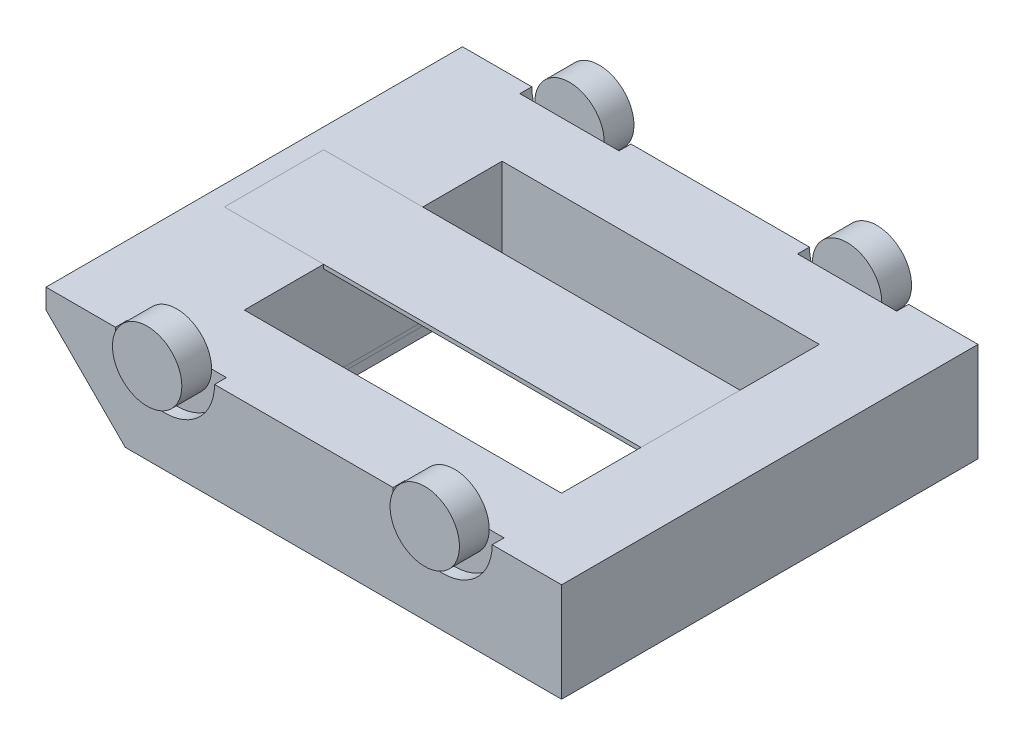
SolidWorks part; units mm, degrees
ref_plane "前视基准面" through (0, 0, 0) normal (0, 0, 1) x (1, 0, 0)
ref_plane "上视基准面" through (0, 0, 0) normal (0, 1, 0) x (1, 0, 0)
ref_plane "右视基准面" through (0, 0, 0) normal (1, 0, 0) x (0, 0, -1)
sketch "草图1" plane through (0, 0, 0) normal (0, 1, 0) x (1, 0, 0)
  line L0 (-400, 650) -> (-400, -650)
  line L1 (-800, -650) -> (800, -650)
  line L2 (-800, -650) -> (-800, 650)
  line L3 (-800, 650) -> (800, 650)
  line L4 (800, -650) -> (800, 650)
  line L5 (-800, -650) -> (800, 650) construction
  line L6 (-800, 650) -> (800, -650) construction
  line L7 (300, 650) -> (300, -650)
  line L8 (0, 0) -> (0, 815.0101) construction
  point P0 (0, 0)
  dimension "D1" = 1600
  dimension "D2" = 1300
  dimension "D3" = 400
other "槽钢 10(1)"
ref_plane "基准面1" through (-800, 0, 650) normal (0, 0, -1) x (0, 1, 0)
sketch "Sketch11" plane through (-800, 0, 650) normal (0, 0, -1) x (0, 1, 0)
  line L0 (0, 0) -> (0, -100)
  line L1 (0, -100) -> (-48, -100)
  line L2 (0, -50) -> (-5.3, -50) construction
  line L3 (-5.3, -82.1991) -> (-5.3, -17.8009)
  line L4 (-13.1549, -90.6746) -> (-44.0725, -93.0278)
  line L5 (-48, -97.2655) -> (-48, -100)
  line L6 (-5.3, -90.0767) -> (-5.3, -93.3267) construction
  line L7 (-5.3, -93.3267) -> (-48, -93.3267) construction
  line L8 (-24, -100) -> (-24, -91.5) construction
  line L9 (-48, -2.7345) -> (-48, 0)
  line L10 (0, 0) -> (-48, 0)
  line L11 (-13.1549, -9.3254) -> (-44.0725, -6.9722)
  arc A0 (-5.3, -82.1991) -> (-13.1549, -90.6746) centre (-13.8, -82.1991) cw
  arc A1 (-13.1549, -9.3254) -> (-5.3, -17.8009) centre (-13.8, -17.8009) cw
  arc A2 (-44.0725, -93.0278) -> (-48, -97.2655) centre (-43.75, -97.2655) ccw
  arc A3 (-48, -2.7345) -> (-44.0725, -6.9722) centre (-43.75, -2.7345) ccw
  point P2 (-24, 0)
  point P17 (0, 0)
  point P20 (-5.3, -9.9233)
  point P26 (-48, -6.6733)
  point P27 (0, 0)
  dimension "r" = 8.5
  dimension "r1" = 4.25
  dimension "h" = 100
  dimension "b" = 48
  dimension "d" = 5.3
  dimension "t" = 8.5
  dimension "D5" = 42.7
  dimension "D6" = 3.25
sketch "草图4" plane through (0, -5.3, 0) normal (0, -1, 0) x (1, 0, 0)
  line L0 (0, 0) -> (1143.0401, 0) construction
  line L1 (817.8009, 667.8009) -> (817.8009, -667.8009) construction
  line L2 (817.8009, -670) -> (882.1991, -670)
  line L3 (817.8009, -670) -> (817.8009, -690)
  line L4 (817.8009, -690) -> (882.1991, -690)
  line L5 (882.1991, -670) -> (882.1991, -690)
  line L6 (882.1991, 732.1991) -> (882.1991, -732.1991) construction
  line L7 (882.1991, 670) -> (882.1991, 690)
  line L8 (817.8009, 690) -> (882.1991, 690)
  line L9 (817.8009, 670) -> (817.8009, 690)
  line L10 (817.8009, 670) -> (882.1991, 670)
  line L12 (-882.1991, 440) -> (-817.8009, 440)
  line L13 (-882.1991, 440) -> (-882.1991, 420)
  line L14 (-882.1991, 420) -> (-817.8009, 420)
  line L15 (-817.8009, 440) -> (-817.8009, 420)
  line L17 (-817.8009, -440) -> (-817.8009, -420)
  line L18 (-882.1991, -420) -> (-817.8009, -420)
  line L19 (-882.1991, -440) -> (-882.1991, -420)
  line L20 (-882.1991, -440) -> (-817.8009, -440)
  line L21 (-882.1991, -732.1991) -> (-882.1991, 732.1991) construction
  line L22 (-817.8009, -667.8009) -> (-817.8009, 667.8009) construction
  point P11 (850, -690)
  dimension "D1" = 20
  dimension "D2" = 690
  dimension "D3" = 20
  dimension "D4" = 880
extrude "凸台-拉伸1" add sketch "草图4" along normal blind 90
sketch "草图5" plane through (0, 0, -690) normal (0, 0, -1) x (-1, 0, 0)
  line L0 (-850, -95.3) -> (-850, -75.3) construction
  line L1 (-817.8009, -95.3) -> (-882.1991, -95.3) construction
  line L2 (850, -95.3) -> (850, -75.3) construction
  line L3 (882.1991, -95.3) -> (817.8009, -95.3) construction
  circle A0 centre (-850, -75.3) radius 10
  circle A1 centre (850, -75.3) radius 10
  dimension "D1" = 20
  dimension "D2" = 20
extrude "切除-拉伸1" cut sketch "草图5" against normal through all
fillet "圆角1" radius 25 4 edges at (882.1991, -95.3, -680) (817.8009, -95.3, -680) (882.1991, -95.3, 680) (817.8009, -95.3, 680)
fillet "圆角2" radius 25 2 edges at (-817.8009, -95.3, 430) (-882.1991, -95.3, 430)
fillet "圆角3" radius 25 2 edges at (-882.1991, -95.3, -430) (-817.8009, -95.3, -430)
sketch "草图7" plane through (0, 0, 0) normal (0, 1, 0) x (1, 0, 0)
  line L1 (-900, 750) -> (900, 750)
  line L2 (-900, 750) -> (-900, -750)
  line L3 (-900, -750) -> (900, -750)
  line L4 (900, 750) -> (900, -750)
extrude "凸台-拉伸3" add sketch "草图7" along normal blind 20 separate body
delete or keep bodies "实体-删除/保留 1" type delete bodies bodies 111
delete or keep bodies "实体-删除/保留 2" type delete bodies bodies 110
sketch "草图8" plane through (0, 20, 0) normal (0, 1, 0) x (1, 0, 0)
  line L0 (0, 0) -> (0, -50000) construction
  line L1 (0, 0) -> (-50000, 0) construction
  line L2 (900, 750) -> (-900, 750) construction
  line L3 (-1400, 1050) -> (1200, 1050)
  line L4 (-1400, 1050) -> (-1400, -1050)
  line L5 (-1400, -1050) -> (1200, -1050)
  line L6 (1200, 1050) -> (1200, -1050)
  line L7 (900, -750) -> (900, 750) construction
  line L8 (-900, 750) -> (-900, -750) construction
  dimension "D1" = 300
  dimension "D2" = 300
  dimension "D3" = 500
extrude "凸台-拉伸4" add sketch "草图8" along normal blind 500 separate body
sketch "草图9" plane through (0, 0, -1050) normal (0, 0, -1) x (-1, 0, 0)
  line L0 (1400, 20) -> (1400, 420)
  line L1 (1400, 520) -> (1400, 20) construction
  line L2 (1400, 420) -> (1000, 20)
  line L3 (-1200, 20) -> (1400, 20) construction
  line L4 (1000, 20) -> (1400, 20)
  dimension "D1" = 45
  dimension "D2" = 400
extrude "切除-拉伸2" cut sketch "草图9" against normal through all
sketch "草图10" plane through (0, 0, 0) normal (0, -1, 0) x (-1, 0, 0)
  line L1 (-800, -650) -> (800, -650)
  line L2 (-800, -650) -> (-800, 650)
  line L3 (-800, 650) -> (800, 650)
  line L4 (800, -650) -> (800, 650)
extrude "切除-拉伸3" cut sketch "草图10" against normal through all
sketch "草图11" plane through (1200, 0, 0) normal (1, 0, 0) x (0, 0, -1)
  line L0 (0, 0) -> (0, 20) construction
  line L1 (-1050, 520) -> (1050, 520) construction
  line L2 (250, 500) -> (-250, 500)
  line L3 (250, 500) -> (250, 520)
  line L4 (250, 520) -> (-250, 520)
  line L5 (-250, 500) -> (-250, 520)
  dimension "D1" = 500
  dimension "D2" = 20
extrude "凸台-拉伸6" add sketch "草图11" against normal blind 2500 separate body
sketch "草图12" plane through (-490, -490, 0) normal (-0.7071, -0.7071, 0) x (0, 0, 1)
  line L0 (0, 687.0281) -> (0, 50687.0281) construction
  line L1 (1050, 1286.9343) -> (-1050, 1286.9343) construction
  line L2 (600, 786.9343) -> (-600, 786.9343)
  line L3 (600, 786.9343) -> (600, 1286.9343)
  line L4 (600, 1286.9343) -> (-600, 1286.9343)
  line L5 (-600, 786.9343) -> (-600, 1286.9343)
  dimension "D1" = 1200
  dimension "D2" = 500
extrude "切除-拉伸4" cut sketch "草图12" against normal blind 40
sketch "草图13" plane through (0, 0, -1050) normal (0, 0, -1) x (-1, 0, 0)
  line L0 (0, 0) -> (0, 50000) construction
  line L1 (-1200, 520) -> (1400, 520) construction
  line L2 (-1200, 520) -> (-1200, 20) construction
  circle A0 centre (800, 520) radius 250
  circle A1 centre (-600, 520) radius 250
  dimension "D1" = 500
  dimension "D2" = 600
  dimension "D3" = 600
extrude "切除-拉伸5" cut sketch "草图13" against normal blind 60
sketch "草图14" plane through (0, 0, 1050) normal (0, 0, 1) x (1, 0, 0)
  line L0 (0, 0) -> (0, 50000) construction
  line L1 (-1400, 520) -> (1200, 520) construction
  line L2 (-1400, 520) -> (-1400, 420) construction
  circle A0 centre (600, 520) radius 250
  circle A1 centre (-800, 520) radius 250
  dimension "D1" = 500
  dimension "D2" = 500
  dimension "D3" = 600
  dimension "D4" = 600
extrude "切除-拉伸6" cut sketch "草图14" against normal blind 60
sketch "草图15" plane through (0, 0, 990) normal (0, 0, 1) x (1, 0, 0)
  line L0 (350, 520) -> (850, 520) construction
  line L1 (-1050, 520) -> (-550, 520) construction
  circle A0 centre (600, 520) radius 175
  circle A1 centre (-800, 520) radius 175
  dimension "D1" = 350
extrude "凸台-拉伸7" add sketch "草图15" along normal blind 150 separate body
sketch "草图16" plane through (0, 0, -990) normal (0, 0, -1) x (-1, 0, 0)
  line L0 (550, 520) -> (1050, 520) construction
  line L1 (-850, 520) -> (-350, 520) construction
  circle A0 centre (800, 520) radius 175
  circle A1 centre (-600, 520) radius 175
extrude "凸台-拉伸8" add sketch "草图16" along normal blind 150 separate body
